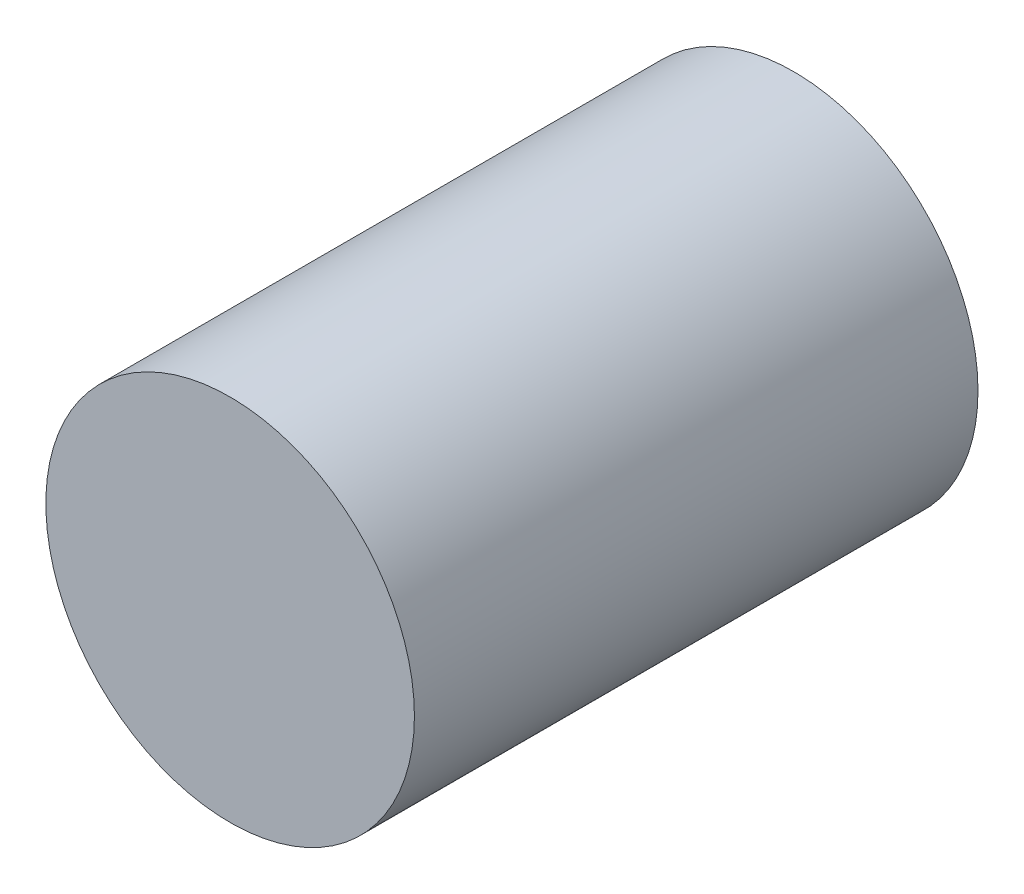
SolidWorks part; units mm, degrees
ref_plane "Plan1" through (0, 0, 0) normal (0, 0, 1) x (1, 0, 0)
ref_plane "Plan2" through (0, 0, 0) normal (0, 1, 0) x (1, 0, 0)
ref_plane "Plan3" through (0, 0, 0) normal (1, 0, 0) x (0, 0, -1)
sketch "Esquisse1" plane through (0, 0, 0) normal (0, 0, 1) x (1, 0, 0)
  circle A0 centre (-50, 50) radius 5
  dimension "D1" = 10
extrude "Base-Extrusion" add sketch "Esquisse1" along normal blind 15.29
